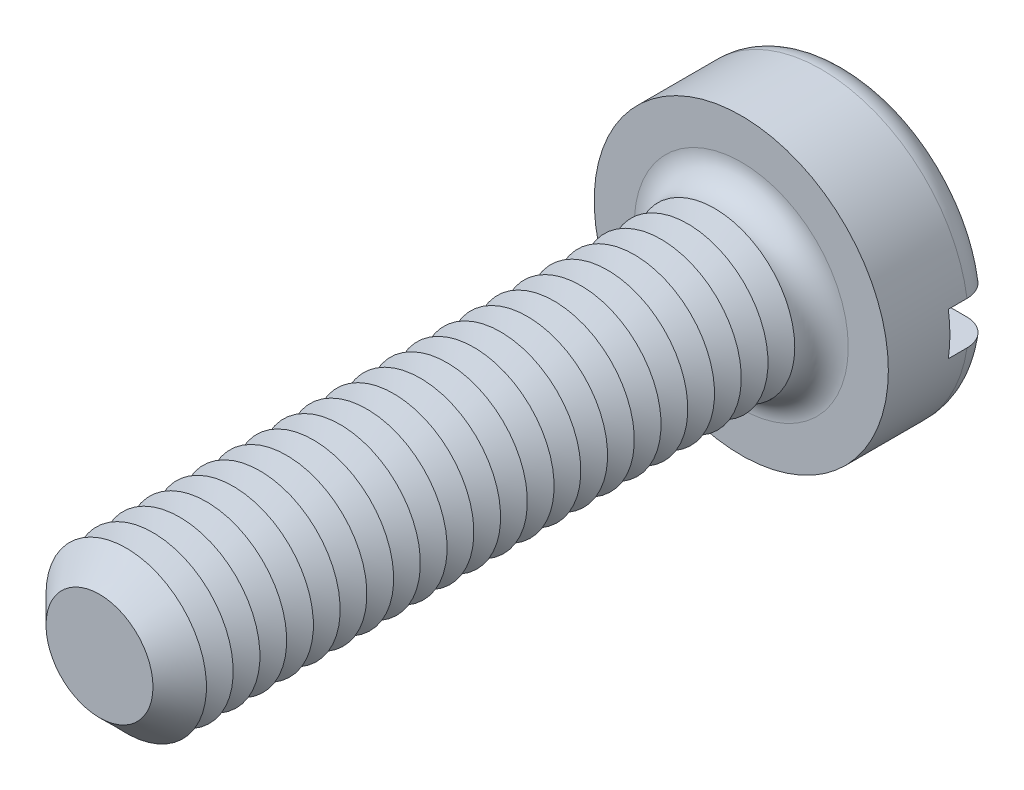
SolidWorks part; units mm, degrees
ref_plane "Front Plane" through (0, 0, 0) normal (0, 0, 1) x (1, 0, 0)
ref_plane "Top Plane" through (0, 0, 0) normal (0, 1, 0) x (1, 0, 0)
ref_plane "Right Plane" through (0, 0, 0) normal (1, 0, 0) x (0, 0, -1)
sketch "Sketch3" plane through (0, 0, 0) normal (0, 0, 1) x (1, 0, 0)
  circle A0 centre (0, 0) radius 2.75
  dimension "D1" = 5.5
extrude "Boss-Extrude2" add sketch "Sketch3" against normal blind 2
sketch "Sketch4" plane through (0, 0, 0) normal (0, 0, 1) x (1, 0, 0)
  circle A0 centre (0, 0) radius 1.5
  dimension "D1" = 3
extrude "Boss-Extrude3" add sketch "Sketch4" along normal blind 12
fillet "Fillet1" radius 0.5 2 edges at (2.75, 0, -2) (1.5, 0, 0)
chamfer "Chamfer1" distance 0.5 angle 45 1 edges at (1.5, 0, 12)
sketch "Sketch5" plane through (0, 0, 0) normal (1, 0, 0) x (0, 0, -1)
  line L0 (1.6944, 0) -> (-7.6738, 0) construction
sketch "Sketch6" plane through (0, 0, 0) normal (1, 0, 0) x (0, 0, -1)
  line L0 (-0.5, 1.5) -> (-0.75, 1.067)
  line L1 (-0.75, 1.067) -> (-1, 1.5)
  line L2 (-0.5, 1.5) -> (-11.5, 1.5) construction
  line L3 (-1, 1.5) -> (-0.5, 1.5)
  dimension "D1" = 0.5
revolve "Cut-Revolve1" cut sketch "Sketch6" angle 360 about L0
pattern_linear "LPattern1" count 22 spacing 0.5 along (0, 0, 1) of "Cut-Revolve1"
sketch "Sketch8" plane through (0, 0, -2) normal (0, 0, -1) x (-1, 0, 0)
  line L1 (2.75, -0.4) -> (-2.75, -0.4)
  line L2 (2.75, -0.4) -> (2.75, 0.4)
  line L3 (2.75, 0.4) -> (-2.75, 0.4)
  line L4 (-2.75, -0.4) -> (-2.75, 0.4)
  line L5 (2.75, -0.4) -> (-2.75, 0.4) construction
  line L6 (2.75, 0.4) -> (-2.75, -0.4) construction
  point P0 (0, 0)
  dimension "D1" = 5.5
  dimension "D2" = 0.8
extrude "Cut-Extrude1" cut sketch "Sketch8" against normal blind 0.85
